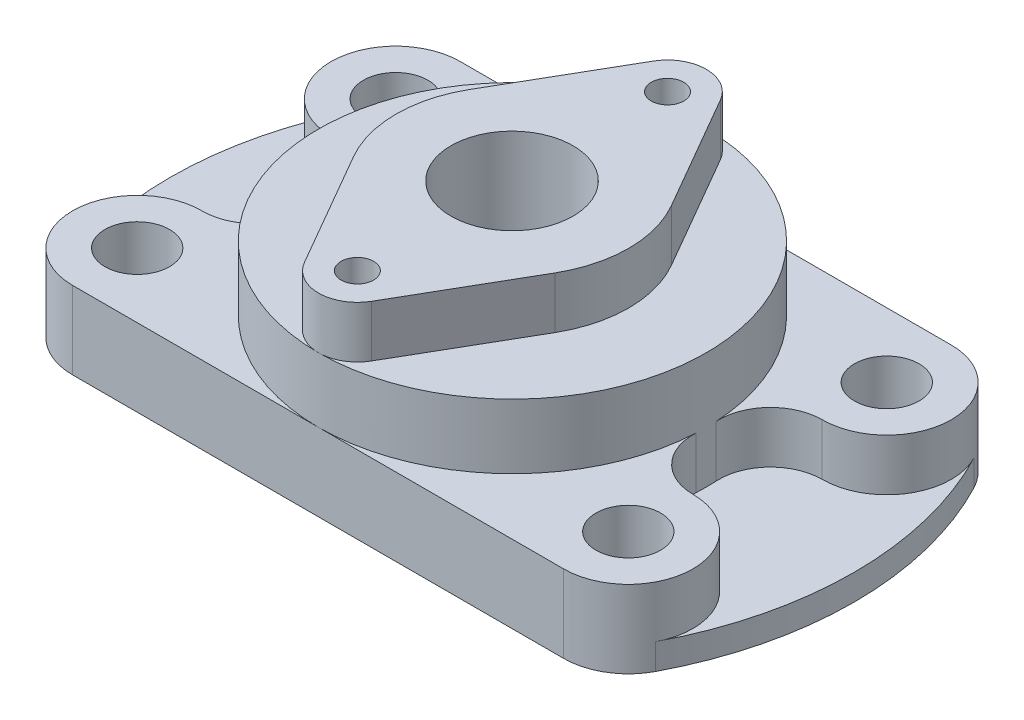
SolidWorks part; units mm, degrees
ref_plane "Front" through (0, 0, 0) normal (0, 0, 1) x (1, 0, 0)
ref_plane "Top" through (0, 0, 0) normal (0, 1, 0) x (1, 0, 0)
ref_plane "Right" through (0, 0, 0) normal (1, 0, 0) x (0, 0, -1)
sketch "Sketch1" plane through (0, 0, 0) normal (0, 1, 0) x (1, 0, 0)
  line L0 (-30, 16) -> (30, -16) construction
  line L1 (-30, 24) -> (30, 24)
  line L2 (-14.6169, 6.6316) -> (-6.6907, 21.3684)
  line L3 (-30, -24) -> (30, -24)
  line L4 (2.1163, 21.3684) -> (10.0425, 6.6316)
  line L5 (10.0425, -6.6316) -> (2.1163, -21.3684)
  line L6 (-6.6907, -21.3684) -> (-14.6169, -6.6316)
  arc A0 (-36.9282, 20) -> (-30, 24) centre (-30, 16) cw
  arc A1 (-30, -24) -> (-36.9282, -20) centre (-30, -16) cw
  arc A2 (36.9282, -20) -> (30, -24) centre (30, -16) cw
  arc A3 (36.9282, 20) -> (30, 24) centre (30, 16) ccw
  arc A4 (-36.9282, -20) -> (-36.9282, 20) centre (-2.2872, 0) cw
  arc A5 (36.9282, 20) -> (36.9282, -20) centre (2.2872, 0) cw
  circle A6 centre (-2.2872, 0) radius 24
  circle A7 centre (30, 16) radius 8
  circle A8 centre (30, -16) radius 8
  circle A9 centre (-30, -16) radius 8
  circle A10 centre (-30, 16) radius 8
  arc A11 (-31.2618, 8.1001) -> (-26.224, 1.7402) centre (-32.2082, 2.1752) cw
  arc A12 (-31.2618, -8.1001) -> (-26.224, -1.7402) centre (-32.2082, -2.1752) ccw
  arc A13 (28.6468, 8.1153) -> (21.6481, 1.7614) centre (27.6319, 2.2017) ccw
  arc A14 (28.6468, -8.1153) -> (21.6481, -1.7614) centre (27.6319, -2.2017) cw
  arc A15 (-6.6907, 21.3684) -> (2.1163, 21.3684) centre (-2.2872, 19) cw
  arc A16 (10.0425, 6.6316) -> (10.0425, -6.6316) centre (-2.2872, 0) cw
  arc A17 (2.1163, -21.3684) -> (-6.6907, -21.3684) centre (-2.2872, -19) cw
  arc A18 (-14.6169, -6.6316) -> (-14.6169, 6.6316) centre (-2.2872, 0) cw
  circle A19 centre (-2.2872, 19) radius 2.5
  circle A20 centre (-2.2872, -19) radius 2.5
  circle A21 centre (2.2872, 0) radius 7
  circle A22 centre (30, 16) radius 4
  circle A23 centre (30, -16) radius 4
  circle A24 centre (-30, 16) radius 4
  circle A25 centre (-30, -16) radius 4
  dimension "D1" = 8
  dimension "D2" = 60
  dimension "D3" = 40
  dimension "D4" = 32
  dimension "D5" = 6
  dimension "D6" = 5
  dimension "D7" = 14
  dimension "D8" = 5
  dimension "D9" = 14
  dimension "D10" = 8
sketch "Sketch2" plane through (0, 0, 0) normal (0, 1, 0) x (1, 0, 0)
  line L0 (-30.1625, 23.8125) -> (30.1625, 23.8125)
  line L1 (-30.1625, -23.8125) -> (30.1625, -23.8125)
  arc A0 (-37.1892, 19.5669) -> (-30.1625, 23.8125) centre (-30.1625, 15.875) cw
  arc A1 (-30.1625, -23.8125) -> (-37.1892, -19.5669) centre (-30.1625, -15.875) cw
  arc A2 (37.1892, -19.5669) -> (30.1625, -23.8125) centre (30.1625, -15.875) cw
  arc A3 (37.1892, 19.5669) -> (30.1625, 23.8125) centre (30.1625, 15.875) ccw
  arc A4 (-37.1892, -19.5669) -> (-37.1892, 19.5669) centre (0.0522, 0) cw
  arc A5 (37.1892, 19.5669) -> (37.1892, -19.5669) centre (-0.0522, 0) cw
extrude "Base-Extrude" add sketch "Sketch2" along normal blind 3.175
sketch "Sketch3" plane through (0, 0, 0) normal (0, 1, 0) x (1, 0, 0)
  line L0 (-30.1625, 23.8125) -> (30.1625, 23.8125)
  line L1 (-30.1625, -23.8125) -> (30.1625, -23.8125)
  arc A1 (30.1683, 7.9375) -> (30.1625, 23.8125) centre (30.1625, 15.875) ccw
  arc A2 (30.1625, -23.8125) -> (30.1683, -7.9375) centre (30.1625, -15.875) ccw
  arc A3 (-30.1103, -7.9377) -> (-30.1625, -23.8125) centre (-30.1625, -15.875) ccw
  arc A4 (-30.1625, 23.8125) -> (-30.1103, 7.9377) centre (-30.1625, 15.875) ccw
  arc A5 (-30.1103, 7.9377) -> (-23.7273, 1.2535) centre (-30.0685, 1.5878) cw
  arc A6 (-30.1103, -7.9377) -> (-23.7273, -1.2535) centre (-30.0685, -1.5878) ccw
  arc A7 (30.1683, 7.9375) -> (23.8317, 1.2533) centre (30.1729, 1.5875) ccw
  arc A8 (30.1683, -7.9375) -> (23.8317, -1.2533) centre (30.1729, -1.5875) cw
  arc A10 (23.8317, -1.2533) -> (23.8317, 1.2533) centre (0.0522, 0) ccw
  arc A11 (-23.7273, 1.2535) -> (-23.7273, -1.2535) centre (0.0522, 0) ccw
extrude "Boss-Extrude1" add sketch "Sketch3" along normal blind 9.525
sketch "Sketch4" plane through (0, 0, 0) normal (0, 1, 0) x (1, 0, 0)
  circle A0 centre (0.0522, 0) radius 23.8125
extrude "Boss-Extrude2" add sketch "Sketch4" along normal blind 17.4625
sketch "Sketch5" plane through (0, 0, 0) normal (0, 1, 0) x (1, 0, 0)
  line L0 (-12.3212, 7.1437) -> (-4.0723, 21.4312)
  line L1 (4.1766, 21.4312) -> (12.4255, 7.1437)
  line L2 (12.4255, -7.1438) -> (4.1766, -21.4313)
  line L3 (-4.0723, -21.4313) -> (-12.3212, -7.1438)
  arc A0 (-4.0723, 21.4312) -> (4.1766, 21.4312) centre (0.0522, 19.05) cw
  arc A1 (12.4255, 7.1437) -> (12.4255, -7.1438) centre (0.0522, 0) cw
  arc A2 (4.1766, -21.4313) -> (-4.0723, -21.4313) centre (0.0522, -19.05) cw
  arc A3 (-12.3212, -7.1438) -> (-12.3212, 7.1437) centre (0.0522, 0) cw
extrude "Boss-Extrude3" add sketch "Sketch5" along normal blind 23.8125
sketch "Sketch8" plane through (0, 0, 0) normal (0, 1, 0) x (1, 0, 0)
  circle A0 centre (-30.1625, -15.875) radius 3.9688
extrude "Cut-Extrude2" cut sketch "Sketch8" along normal through all
mirror "Mirror1" about plane through (0, 0, 0) normal (0, 0, 1) of "Cut-Extrude2"
mirror "Mirror2" about plane through (0, 0, 0) normal (1, 0, 0) of "Mirror1", "Cut-Extrude2"
hole_wizard "Ø15.0 (15) Diameter Hole1" positions "Sketch10" profile "Sketch9" hole size "Ø15.0" standard "Ansi Metric"
sketch "Sketch10" plane through (0, 23.8125, 0) normal (0, 1, 0) x (-1, 0, 0)
  point P0 (0, 0)
sketch "Sketch9" plane through (0, 23.8125, 0) normal (1, 0, 0) x (0, 0, 1)
  line L0 (0, 0) -> (0, 23.8125)
  line L1 (0, 23.8125) -> (7.5, 23.8125)
  line L2 (7.5, 23.8125) -> (7.5, 0)
  line L5 (7.5, 0) -> (0, 0)
  line L11 (0, -6.35) -> (0, 107.95) construction
  dimension "Thru Hole Dia." = 15
  dimension "Thru Hole Depth" = 23.8125
hole_wizard "Ø4.0 (4) Diameter Hole1" positions "Sketch12" profile "Sketch11" hole size "Ø4.0" standard "Ansi Metric"
sketch "Sketch12" plane through (0, 23.8125, 0) normal (0, 1, 0) x (-1, 0, 0)
  point P0 (-0.0522, -19.05)
  point P1 (-0.0522, 19.05)
sketch "Sketch11" plane through (0.0522, 23.8125, -19.05) normal (1, 0, 0) x (0, 0, 1)
  line L0 (0, 0) -> (0, 11.2017)
  line L1 (0, 11.2017) -> (2, 10)
  line L2 (2, 10) -> (2, 0)
  line L5 (2, 0) -> (0, 0)
  line L10 (0, 11.2017) -> (-2, 10) construction
  line L11 (0, -6.35) -> (0, 107.95) construction
  dimension "Hole Dia." = 4
  dimension "Hole Depth" = 10
  dimension "Drill Angle" = 118
